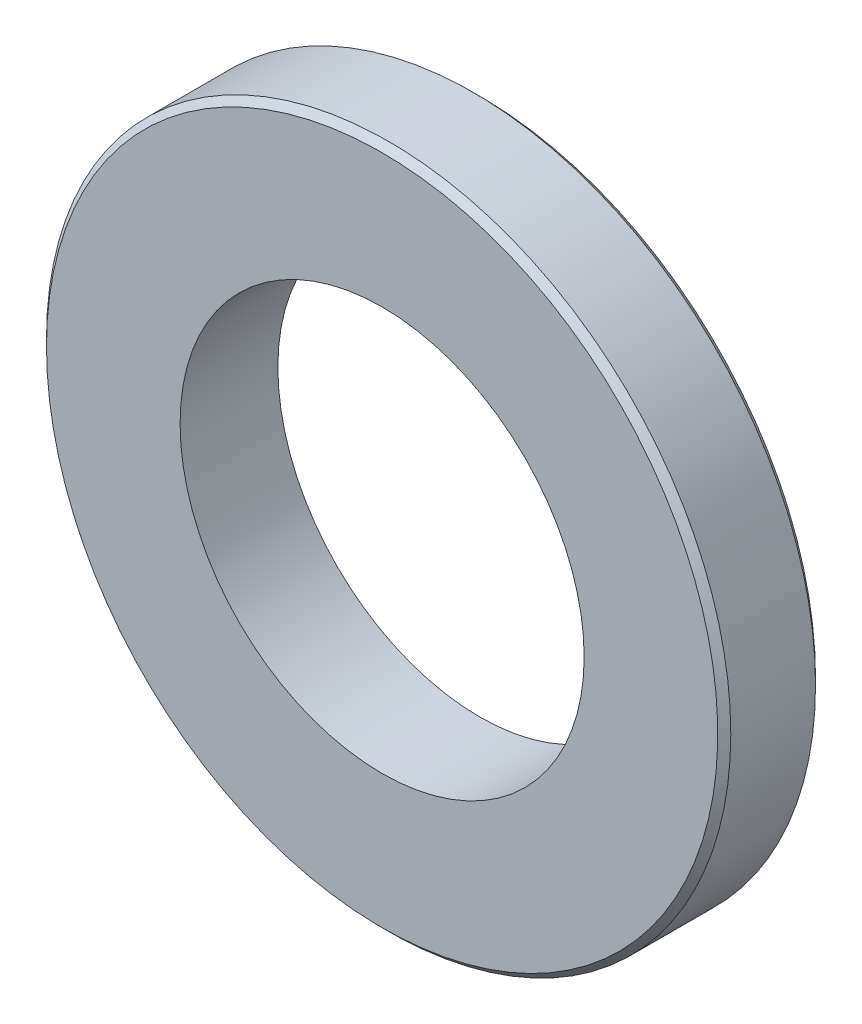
SolidWorks part; units mm, degrees
ref_plane "Plane1" through (0, 0, 0) normal (0, 0, 1) x (1, 0, 0)
ref_plane "Plane2" through (0, 0, 0) normal (0, 1, 0) x (1, 0, 0)
ref_plane "Plane3" through (0, 0, 0) normal (1, 0, 0) x (0, 0, -1)
sketch "Esquisse1" plane through (0, 0, 0) normal (0, 0, 1) x (1, 0, 0)
  circle A0 centre (0, 0) radius 5.25
  circle A1 centre (0, 0) radius 3.1
  dimension "D1" = 10.5
  dimension "D2" = 6.2
extrude "Base-Extrusion" add sketch "Esquisse1" along normal blind 1.5
chamfer "Chanfrein1" distance 0.1 angle 45
